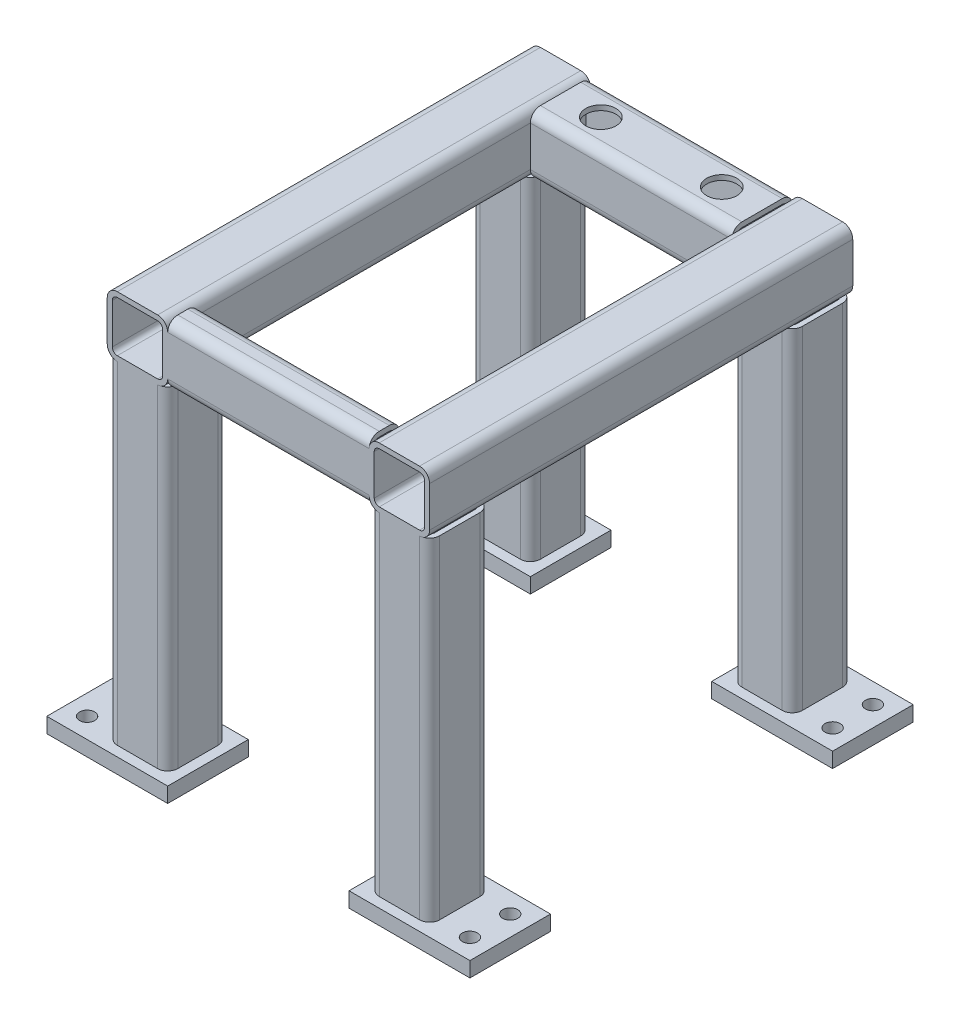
SolidWorks part; units mm, degrees
ref_plane "front" through (0, 0, 0) normal (0, 0, 1) x (1, 0, 0)
ref_plane "top" through (0, 0, 0) normal (0, 1, 0) x (1, 0, 0)
ref_plane "side" through (0, 0, 0) normal (1, 0, 0) x (0, 0, -1)
sketch "Sketch4" plane through (0, 0, 0) normal (1, 0, 0) x (0, 0, -1)
  line L0 (-63.5, -76.2) -> (-12.7, -76.2)
  line L1 (-76.2, -63.5) -> (-76.2, -12.7)
  line L2 (-12.7, 0) -> (-63.5, 0)
  line L3 (0, -12.7) -> (0, -63.5)
  line L4 (50, 0) -> (-50, 0) construction
  line L5 (0, 50) -> (0, -50) construction
  arc A0 (-12.7, -76.2) -> (0, -63.5) centre (-12.7, -63.5) ccw
  arc A1 (-76.2, -63.5) -> (-63.5, -76.2) centre (-63.5, -63.5) ccw
  arc A2 (-63.5, 0) -> (-76.2, -12.7) centre (-63.5, -12.7) ccw
  arc A3 (0, -12.7) -> (-12.7, 0) centre (-12.7, -12.7) ccw
  dimension "D1" = 12.7
  dimension "D5" = 76.2
  dimension "D6" = 76.2
extrude "Base-Extrude-Thin" add sketch "Sketch4" along normal blind 127 thin
sketch "Sketch5" plane through (0, 0, 0) normal (0, 0, -1) x (-1, 0, 0)
  line L0 (-190.5, -76.2) -> (-139.7, -76.2)
  line L1 (-203.2, -63.5) -> (-203.2, -12.7)
  line L2 (-139.7, 0) -> (-190.5, 0)
  line L3 (-127, -12.7) -> (-127, -63.5)
  line L4 (-127, 0) -> (0, 0) construction
  line L5 (-127, -12.7) -> (-127, -63.5) construction
  arc A0 (-139.7, -76.2) -> (-127, -63.5) centre (-139.7, -63.5) ccw
  arc A1 (-203.2, -63.5) -> (-190.5, -76.2) centre (-190.5, -63.5) ccw
  arc A2 (-190.5, 0) -> (-203.2, -12.7) centre (-190.5, -12.7) ccw
  arc A3 (-127, -12.7) -> (-139.7, 0) centre (-139.7, -12.7) ccw
  dimension "D1" = 12.7
  dimension "D5" = 76.2
  dimension "D6" = 76.2
extrude "Boss-Extrude-Thin2" add sketch "Sketch5" against normal blind 533.4 thin
sketch "Sketch6" plane through (127, 0, 0) normal (-1, 0, 0) x (0, 0, 1)
  line L0 (508, -76.2) -> (520.7, -76.2)
  line L1 (495.3, -63.5) -> (495.3, -12.7)
  line L2 (520.7, 0) -> (508, 0)
  line L3 (533.4, -12.7) -> (533.4, -63.5)
  line L4 (533.4, 0) -> (0, 0) construction
  line L5 (533.4, -12.7) -> (533.4, -63.5) construction
  arc A0 (520.7, -76.2) -> (533.4, -63.5) centre (520.7, -63.5) ccw
  arc A1 (495.3, -63.5) -> (508, -76.2) centre (508, -63.5) ccw
  arc A2 (508, 0) -> (495.3, -12.7) centre (508, -12.7) ccw
  arc A3 (533.4, -12.7) -> (520.7, 0) centre (520.7, -12.7) ccw
  dimension "D1" = 12.7
  dimension "D5" = 38.1
  dimension "D6" = 76.2
extrude "Boss-Extrude-Thin3" add sketch "Sketch6" along normal up to surface (127 mm away) thin
sketch "Sketch8" plane through (0, 0, 0) normal (0, 0, -1) x (-1, 0, 0)
  line L0 (-126.238, -76.2) -> (-127, -75.438)
  line L1 (0, -76.2) -> (-127, -76.2) construction
  line L2 (-127, -76.2) -> (-127, -63.5) construction
  line L3 (-127, -75.438) -> (-127, -76.2)
  line L4 (-127, -76.2) -> (-126.238, -76.2)
  dimension "D1" = 0.762
  dimension "D2" = 0.762
ref_plane "Plane4" through (0, -793.75, 0) normal (0, 1, 0) x (-1, 0, 0)
sketch "Sketch7" plane through (-555.7483, -514.35, 156.5679) normal (0, -1, 0) x (1, 0, 0)
  line L0 (695.4483, -156.5679) -> (746.2483, -156.5679)
  line L1 (682.7483, -143.8679) -> (682.7483, -93.0679)
  line L2 (746.2483, -80.3679) -> (695.4483, -80.3679)
  line L3 (758.9483, -93.0679) -> (758.9483, -143.8679)
  line L4 (758.9483, 376.8321) -> (758.9483, -156.5679) construction
  line L5 (746.2483, -156.5679) -> (695.4483, -156.5679) construction
  arc A0 (746.2483, -156.5679) -> (758.9483, -143.8679) centre (746.2483, -143.8679) ccw
  arc A1 (682.7483, -143.8679) -> (695.4483, -156.5679) centre (695.4483, -143.8679) ccw
  arc A2 (695.4483, -80.3679) -> (682.7483, -93.0679) centre (695.4483, -93.0679) ccw
  arc A3 (758.9483, -93.0679) -> (746.2483, -80.3679) centre (746.2483, -93.0679) ccw
  dimension "D1" = 12.7
  dimension "D5" = 76.2
  dimension "D6" = 76.2
extrude "Boss-Extrude-Thin4" add sketch "Sketch7" against normal offset from surface (438.404 mm away) 0.254 thin
sketch "Sketch9" plane through (-555.7483, -514.35, 156.5679) normal (0, -1, 0) x (1, 0, 0)
  line L0 (695.4483, 300.6321) -> (746.2483, 300.6321)
  line L1 (682.7483, 313.3321) -> (682.7483, 364.1321)
  line L2 (746.2483, 376.8321) -> (695.4483, 376.8321)
  line L3 (758.9483, 364.1321) -> (758.9483, 313.3321)
  line L4 (746.2483, 376.8321) -> (695.4483, 376.8321) construction
  line L5 (758.9483, 376.8321) -> (758.9483, -156.5679) construction
  arc A0 (746.2483, 300.6321) -> (758.9483, 313.3321) centre (746.2483, 313.3321) ccw
  arc A1 (682.7483, 313.3321) -> (695.4483, 300.6321) centre (695.4483, 313.3321) ccw
  arc A2 (695.4483, 376.8321) -> (682.7483, 364.1321) centre (695.4483, 364.1321) ccw
  arc A3 (758.9483, 364.1321) -> (746.2483, 376.8321) centre (746.2483, 364.1321) ccw
  dimension "D1" = 12.7
  dimension "D5" = 76.2
  dimension "D6" = 76.2
extrude "Boss-Extrude-Thin5" add sketch "Sketch9" against normal offset from surface (438.404 mm away) 0.254 thin
sketch "Sketch10" plane through (-258.3564, -514.35, 160.0214) normal (0, -1, 0) x (0, 0, -1)
  line L0 (71.1214, 525.0564) -> (172.7214, 525.0564)
  line L1 (71.1214, 525.0564) -> (71.1214, 372.6564)
  line L2 (172.7214, 372.6564) -> (71.1214, 372.6564)
  line L3 (172.7214, 372.6564) -> (172.7214, 525.0564)
  line L4 (147.3214, 385.3564) -> (96.5214, 385.3564) construction
  line L5 (160.0214, 398.0564) -> (160.0214, 448.8564) construction
  line L7 (172.7214, 499.6564) -> (71.1214, 499.6564) construction
  circle A0 centre (147.3214, 499.6564) radius 9.525
  circle A2 centre (96.5214, 499.6564) radius 9.525
  dimension "D6" = 19.05
  dimension "D1" = 101.6
  dimension "D2" = 12.7
  dimension "D3" = 12.7
  dimension "D4" = 152.4
  dimension "D5" = 25.4
  dimension "D7" = 25.4
  dimension "D8" = 25.4
extrude "Boss-Extrude7" add sketch "Sketch10" against normal blind 19.05
sketch "Sketch11" plane through (-249.9132, -514.35, 836.6457) normal (0, -1, 0) x (0, 0, -1)
  line L0 (290.5457, 516.6132) -> (392.1457, 516.6132)
  line L1 (290.5457, 516.6132) -> (290.5457, 364.2132)
  line L2 (392.1457, 364.2132) -> (290.5457, 364.2132)
  line L3 (392.1457, 364.2132) -> (392.1457, 516.6132)
  line L4 (366.7457, 376.9132) -> (315.9457, 376.9132) construction
  line L5 (303.2457, 440.4132) -> (303.2457, 389.6132) construction
  line L7 (392.1457, 491.2132) -> (290.5457, 491.2132) construction
  circle A0 centre (366.7457, 491.2132) radius 9.525
  circle A2 centre (315.9457, 491.2132) radius 9.525
  dimension "D6" = 19.05
  dimension "D1" = 101.6
  dimension "D2" = 12.7
  dimension "D3" = 12.7
  dimension "D4" = 152.4
  dimension "D5" = 25.4
  dimension "D7" = 25.4
  dimension "D8" = 25.4
extrude "Boss-Extrude8" add sketch "Sketch11" against normal blind 19.05
mirror "Boss-Mirror1"
sketch "Sketch12" plane through (0, -76.2, 0) normal (0, -1, 0) x (1, 0, 0)
  line L0 (0, -50) -> (0, 50) construction
  line L1 (127, 0) -> (-127, 0) construction
  circle A2 centre (-76.2, 38.1) radius 19.05
  circle A3 centre (76.2, 38.1) radius 19.05
  dimension "D4" = 38.1
  dimension "D1" = 152.4
  dimension "D2" = 76.2
  dimension "D3" = 38.1
extrude "Cut-Extrude1" cut sketch "Sketch12" against normal through all
